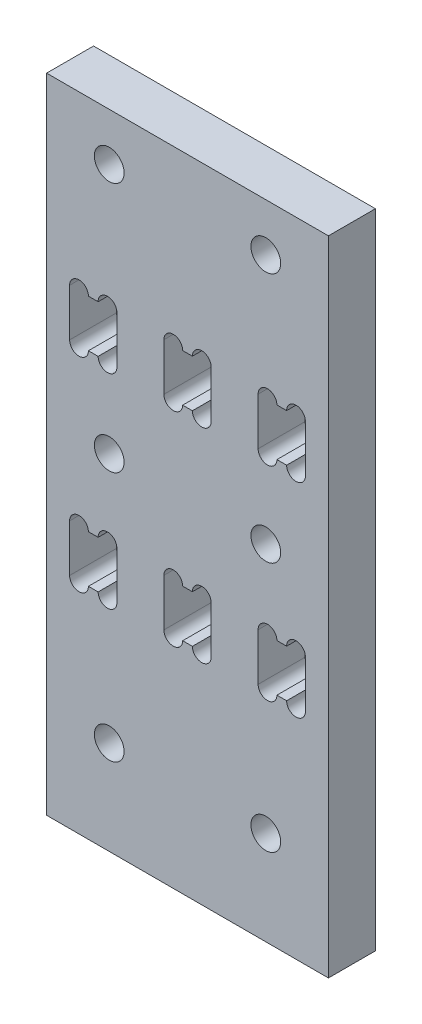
SolidWorks part; units mm, degrees
ref_plane "Ebene vorne" through (0, 0, 0) normal (0, 0, 1) x (1, 0, 0)
ref_plane "Ebene oben" through (0, 0, 0) normal (0, 1, 0) x (1, 0, 0)
ref_plane "Ebene rechts" through (0, 0, 0) normal (1, 0, 0) x (0, 0, -1)
sketch "Skizze1" plane through (0, 0, 0) normal (0, 0, 1) x (1, 0, 0)
  line L0 (0, 0) -> (90, 0)
  line L1 (90, 0) -> (90, 205.25)
  line L2 (90, 205.25) -> (0, 205.25)
  line L3 (0, 205.25) -> (0, 0)
  line L4 (7.35, 85.1) -> (7.35, 70)
  line L5 (22.45, 85.1) -> (22.45, 70)
  line L6 (37.45, 85.1) -> (37.45, 70)
  line L7 (52.55, 85.1) -> (52.55, 70)
  line L8 (67.55, 85.1) -> (67.55, 70)
  line L9 (82.65, 85.1) -> (82.65, 70)
  line L10 (13.35, 85.1) -> (16.45, 85.1)
  line L11 (73.55, 85.1) -> (76.65, 85.1)
  line L12 (43.45, 85.1) -> (46.55, 85.1)
  line L13 (13.35, 70) -> (16.45, 70)
  line L14 (43.45, 70) -> (46.55, 70)
  line L15 (76.65, 70) -> (73.55, 70)
  line L16 (7.35, 150.25) -> (7.35, 135.15)
  line L17 (22.45, 150.25) -> (22.45, 135.15)
  line L18 (82.65, 150.25) -> (82.65, 135.15)
  line L19 (43.45, 150.25) -> (46.55, 150.25)
  line L20 (13.35, 135.15) -> (16.45, 135.15)
  line L21 (73.55, 150.25) -> (76.65, 150.25)
  line L22 (67.55, 150.25) -> (67.55, 135.15)
  line L23 (13.35, 150.25) -> (16.45, 150.25)
  line L24 (52.55, 150.25) -> (52.55, 135.15)
  line L25 (43.45, 135.15) -> (46.55, 135.15)
  line L26 (37.45, 150.25) -> (37.45, 135.15)
  line L27 (76.65, 135.15) -> (73.55, 135.15)
  arc A0 (7.35, 85.1) -> (13.35, 85.1) centre (10.35, 85.1) cw
  arc A1 (16.45, 85.1) -> (22.45, 85.1) centre (19.45, 85.1) cw
  arc A2 (37.45, 85.1) -> (43.45, 85.1) centre (40.45, 85.1) cw
  arc A3 (46.55, 85.1) -> (52.55, 85.1) centre (49.55, 85.1) cw
  arc A4 (67.55, 85.1) -> (73.55, 85.1) centre (70.55, 85.1) cw
  arc A5 (76.65, 85.1) -> (82.65, 85.1) centre (79.65, 85.1) cw
  arc A6 (76.65, 70) -> (82.65, 70) centre (79.65, 70) ccw
  arc A7 (67.55, 70) -> (73.55, 70) centre (70.55, 70) ccw
  arc A8 (46.55, 70) -> (52.55, 70) centre (49.55, 70) ccw
  arc A9 (37.45, 70) -> (43.45, 70) centre (40.45, 70) ccw
  arc A10 (16.45, 70) -> (22.45, 70) centre (19.45, 70) ccw
  arc A11 (7.35, 70) -> (13.35, 70) centre (10.35, 70) ccw
  arc A12 (76.65, 135.15) -> (82.65, 135.15) centre (79.65, 135.15) ccw
  arc A13 (37.45, 135.15) -> (43.45, 135.15) centre (40.45, 135.15) ccw
  arc A14 (7.35, 135.15) -> (13.35, 135.15) centre (10.35, 135.15) ccw
  arc A15 (46.55, 150.25) -> (52.55, 150.25) centre (49.55, 150.25) cw
  arc A16 (67.55, 135.15) -> (73.55, 135.15) centre (70.55, 135.15) ccw
  arc A17 (76.65, 150.25) -> (82.65, 150.25) centre (79.65, 150.25) cw
  arc A18 (16.45, 135.15) -> (22.45, 135.15) centre (19.45, 135.15) ccw
  arc A19 (7.35, 150.25) -> (13.35, 150.25) centre (10.35, 150.25) cw
  arc A20 (67.55, 150.25) -> (73.55, 150.25) centre (70.55, 150.25) cw
  arc A21 (37.45, 150.25) -> (43.45, 150.25) centre (40.45, 150.25) cw
  arc A22 (16.45, 150.25) -> (22.45, 150.25) centre (19.45, 150.25) cw
  arc A23 (46.55, 135.15) -> (52.55, 135.15) centre (49.55, 135.15) ccw
  circle A24 centre (20, 30) radius 4.75
  circle A25 centre (70, 30) radius 4.75
  circle A26 centre (20, 110) radius 4.75
  circle A27 centre (70, 110) radius 4.75
  circle A28 centre (20, 190) radius 4.75
  circle A29 centre (70, 190) radius 4.75
  dimension "D10" = 3
  dimension "D11" = 3
  dimension "D12" = 3
  dimension "D13" = 3
  dimension "D14" = 3
  dimension "D15" = 3
  dimension "D16" = 3
  dimension "D17" = 0
  dimension "D18" = 3
  dimension "D19" = 3
  dimension "D20" = 3
  dimension "D21" = 3
  dimension "D23" = 3
  dimension "D24" = 3
  dimension "D25" = 3
  dimension "D26" = 3
  dimension "D27" = 3
  dimension "D28" = 3
  dimension "D33" = 3
  dimension "D38" = 3
  dimension "D39" = 3
  dimension "D40" = 3
  dimension "D41" = 3
  dimension "D42" = 3
  dimension "D43" = 3
  dimension "D48" = 9.5
  dimension "D52" = 30
  dimension "D53" = 9.5
  dimension "D54" = 9.5
  dimension "D55" = 9.5
  dimension "D56" = 160
  dimension "D58" = 9.5
  dimension "D59" = 20
  dimension "D60" = 9.5
  dimension "D61" = 20
  dimension "D62" = 80
  dimension "D63" = 80
  dimension "D57" = 160
  dimension "D1" = 90
  dimension "D3" = 15.1
  dimension "D4" = 15.1
  dimension "D5" = 15.1
  dimension "D6" = 15
  dimension "D7" = 15
  dimension "D8" = 15.1
  dimension "D9" = 7.35
  dimension "D22" = 70
  dimension "D29" = 15.1
  dimension "D30" = 0
  dimension "D31" = 0
  dimension "D32" = 0
  dimension "D34" = 15.1
  dimension "D35" = 0
  dimension "D36" = 0
  dimension "D37" = 0
  dimension "D44" = 0
  dimension "D45" = 0
  dimension "D46" = 50.05
  dimension "D47" = 55
  dimension "D49" = 20
  dimension "D50" = 30
  dimension "D51" = 20
extrude "Aufsatz-Linear austragen1" add sketch "Skizze1" along normal blind 15
